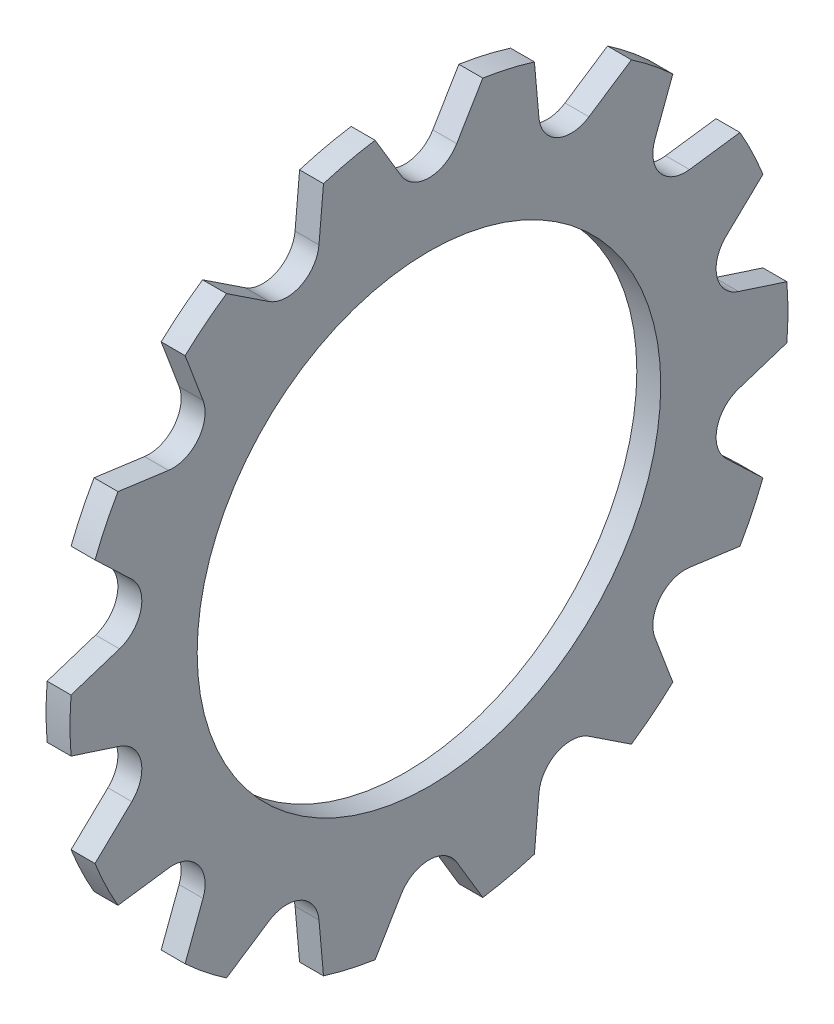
SolidWorks part; units mm, degrees
ref_plane "Plane1" through (0, 0, 0) normal (0, 0, 1) x (1, 0, 0)
ref_plane "Plane2" through (0, 0, 0) normal (0, 1, 0) x (1, 0, 0)
ref_plane "Plane3" through (0, 0, 0) normal (1, 0, 0) x (0, 0, -1)
sketch "Sketch1" plane through (0, 0, 0) normal (1, 0, 0) x (0, 0, -1)
  circle A0 centre (0, 0) radius 15.5
  circle A1 centre (0, 0) radius 24
  dimension "InsideDia" = 31
  dimension "OutsideDia" = 48
extrude "Base-Extrude" add sketch "Sketch1" against normal blind 1.6
sketch "Sketch3" plane through (0, 0, 0) normal (1, 0, 0) x (0, 0, -1)
  line L0 (1.855, 20.8034) -> (3.6, 23.7285)
  line L1 (-1.855, 20.8034) -> (-3.6, 23.7285)
  line L2 (-3.6, 23.7285) -> (-3.6, 25.8885)
  line L3 (-3.6, 25.8885) -> (3.6, 25.8885)
  line L4 (3.6, 25.8885) -> (3.6, 23.7285)
  arc A0 (-1.855, 20.8034) -> (1.855, 20.8034) centre (0, 21.91) ccw
  circle A1 centre (0, 0) radius 24 construction
  circle A2 centre (0, 0) radius 19.75 construction
  dimension "D1" = 4.32
  dimension "D4" = 39.5
  dimension "D2" = 7.2
  dimension "D3" = 2.16
  dimension "D5" = 3.6
extrude "TypeASlot" cut sketch "Sketch3" against normal through all
pattern_circular "TypeAPattern" count 14 over 360 about axis through (0, 0, 0) along (1, 0, 0) of "TypeASlot"
sketch "Sketch2" plane through (0, 0, 0) normal (1, 0, 0) x (0, 0, -1)
  line L0 (2.16, 0) -> (2.16, 17.59)
  line L1 (-2.16, 17.59) -> (-2.16, 0)
  line L2 (-2.16, 0) -> (2.16, 0)
  arc A0 (2.16, 17.59) -> (-2.16, 17.59) centre (0, 17.59) ccw
  circle A3 centre (0, 0) radius 19.75 construction
  dimension "D1" = 39.5
  dimension "SlotWidth" = 4.32
extrude "TypeJSlot" [suppressed] cut sketch "Sketch2" against normal through all
pattern_circular "TypeJPattern" [suppressed] count 14 over 360
equation "\"SlotWidth@Sketch2\" = \"OutsideDia@Sketch1\" * .09"
equation "\"D1@Sketch2\" = \"InsideDia@Sketch1\" +  ( \"OutsideDia@Sketch1\" - \"InsideDia@Sketch1\" )  / 2"
equation "\"D1@Sketch3\" = \"OutsideDia@Sketch1\" * .09"
equation "\"D2@Sketch3\" = \"OutsideDia@Sketch1\" * .15"
equation "\"D3@Sketch3\" = \"D1@Sketch3\" / 2"
equation "\"D4@Sketch3\" = \"InsideDia@Sketch1\" +  ( \"OutsideDia@Sketch1\" - \"InsideDia@Sketch1\" )  / 2"
equation "\"D5@Sketch3\" = \"D2@Sketch3\" / 2"
